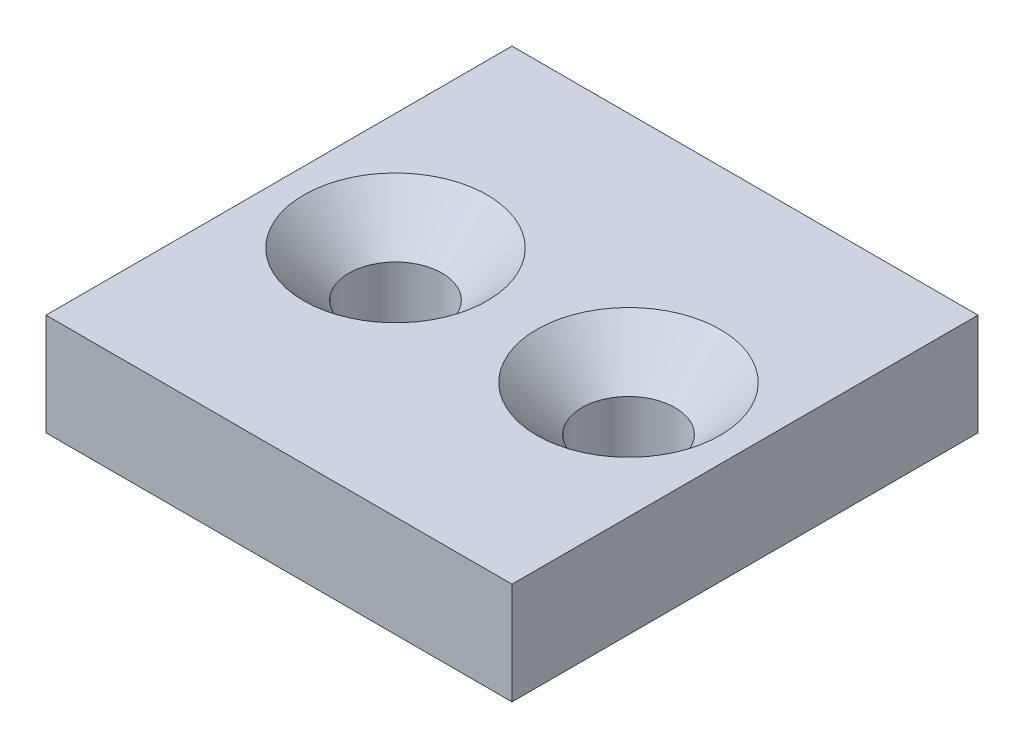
SolidWorks part; units mm, degrees
ref_plane "Front Plane" through (0, 0, 0) normal (0, 0, 1) x (1, 0, 0)
ref_plane "Top Plane" through (0, 0, 0) normal (0, 1, 0) x (1, 0, 0)
ref_plane "Right Plane" through (0, 0, 0) normal (1, 0, 0) x (0, 0, -1)
sketch "Sketch1" plane through (0, 0, 0) normal (0, 1, 0) x (1, 0, 0)
  line L1 (-16, -16) -> (16, -16)
  line L2 (-16, -16) -> (-16, 16)
  line L3 (-16, 16) -> (16, 16)
  line L4 (16, -16) -> (16, 16)
  line L5 (-16, -16) -> (16, 16) construction
  line L6 (-16, 16) -> (16, -16) construction
  point P0 (0, 0)
  dimension "D1" = 32
extrude "Boss-Extrude1" add sketch "Sketch1" along normal blind 7
hole_wizard "CSK for M6 Flat Head Machine Screw1" positions "Sketch3" profile "Sketch2" countersink size "M6" standard "ANSI Metric"
sketch "Sketch3" plane through (0, 7, 0) normal (0, 1, 0) x (-1, 0, 0)
  line L0 (-16, 16) -> (-16, -16) construction
  point P0 (8, 0)
  point P1 (-8, 0)
  dimension "D1" = 8
  dimension "D2" = 16
sketch "Sketch2" plane through (-8, 7, 0) normal (1, 0, 0) x (0, 0, 1)
  line L0 (0, 0) -> (0, 7)
  line L1 (0, 7) -> (3.2, 7)
  line L2 (3.2, 7) -> (3.2, 3.1)
  line L3 (3.2, 3.1) -> (6.3, 0)
  line L5 (6.3, 0) -> (0, 0)
  line L6 (-3.2, 3.1) -> (-6.3, 0) construction
  line L11 (0, -6.35) -> (0, 107.95) construction
  dimension "Thru Hole Dia." = 6.4
  dimension "Thru Hole Depth" = 7
  dimension "Near C'Sink Dia." = 12.6
  dimension "Near C'Sink Angle" = 90
